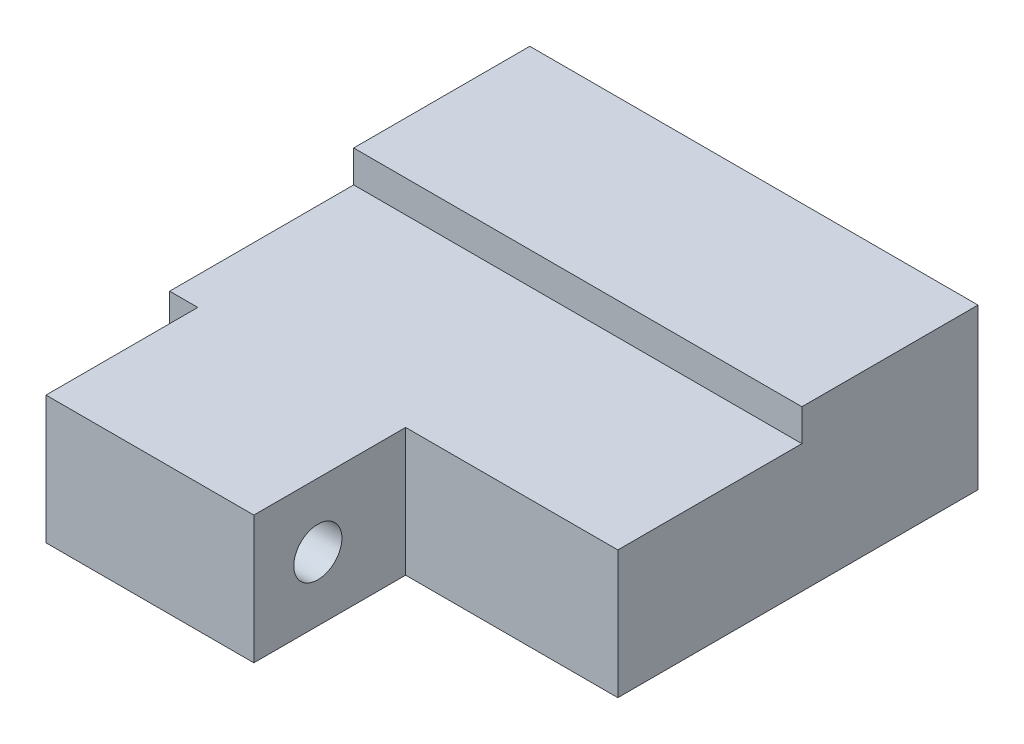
SolidWorks part; units mm, degrees
ref_plane "Front Plane" through (0, 0, 0) normal (0, 0, 1) x (1, 0, 0)
ref_plane "Top Plane" through (0, 0, 0) normal (0, 1, 0) x (1, 0, 0)
ref_plane "Right Plane" through (0, 0, 0) normal (1, 0, 0) x (0, 0, -1)
sketch "Sketch1" plane through (0, 0, 0) normal (0, 0, 1) x (1, 0, 0)
  line L0 (0, 0) -> (0, 28.9276) construction
  line L1 (-22.2377, -11.0998) -> (22.2377, -11.0998)
  line L2 (22.2377, -11.0998) -> (22.2377, 4.7752)
  line L3 (22.2377, 4.7752) -> (-22.2377, 4.7752)
  line L4 (-22.2377, 4.7752) -> (-22.2377, -11.0998)
  circle A0 centre (17.4625, 0) radius 2.3876
  circle A1 centre (-17.4625, 0) radius 2.3876
  dimension "D2" = 4.7752
  dimension "D1" = 34.925
  dimension "D3" = 4.7752
  dimension "D4" = 4.7752
  dimension "D5" = 4.7752
  dimension "D6" = 15.875
sketch "Sketch2" plane through (0, 0, 0) normal (0, 0, 1) x (1, 0, 0)
  line L0 (-22.2377, -11.0998) -> (22.2377, -11.0998) construction
  line L1 (22.2377, -11.0998) -> (22.2377, 4.7752) construction
  line L2 (22.2377, 4.7752) -> (-22.2377, 4.7752) construction
  line L3 (-22.2377, 4.7752) -> (-22.2377, -11.0998) construction
  line L4 (-22.2377, -11.0998) -> (22.2377, -11.0998)
  line L5 (22.2377, -11.0998) -> (22.2377, 4.7752)
  line L6 (22.2377, 4.7752) -> (-22.2377, 4.7752)
  line L7 (-22.2377, 4.7752) -> (-22.2377, -11.0998)
extrude "Boss-Extrude1" add sketch "Sketch2" along normal blind 50.8
sketch "Sketch3" plane through (0, 0, 0) normal (0, 1, 0) x (1, 0, 0)
  line L0 (22.2377, -35.7378) -> (1.1811, -35.7378)
  line L1 (22.2377, -50.8) -> (22.2377, 0) construction
  line L2 (1.1811, -35.7378) -> (1.1811, -50.8)
  line L3 (22.2377, -50.8) -> (-22.2377, -50.8) construction
  line L4 (1.1811, -50.8) -> (22.2377, -50.8)
  line L5 (22.2377, -50.8) -> (22.2377, -35.7378)
  line L6 (-19.4437, -50.8) -> (-19.4437, -35.7378)
  line L7 (-19.4437, -35.7378) -> (-22.2377, -35.7378)
  line L8 (-22.2377, -50.8) -> (-22.2377, 0) construction
  line L9 (-22.2377, -35.7378) -> (-22.2377, -50.8)
  line L10 (-22.2377, -50.8) -> (-19.4437, -50.8)
  line L11 (1.1811, -35.7378) -> (-19.4437, -35.7378) construction
  line L12 (-9.1313, -35.7378) -> (-9.1313, -28.6485) construction
  dimension "D1" = 20.6248
  dimension "D2" = 15.0622
  dimension "D3" = 1.1811
  dimension "D4" = 19.4437
  dimension "D5" = 1.1811
  dimension "D6" = 9.1313
extrude "Cut-Extrude1" cut sketch "Sketch3" against normal mid plane 25.4
sketch "Sketch4" plane through (0, 0, 0) normal (1, 0, 0) x (0, 0, -1)
  line L1 (-50.8, -11.0998) -> (-50.8, 4.7752) construction
  line L2 (-35.7378, -11.0998) -> (-50.8, -11.0998) construction
  circle A0 centre (-44.45, -4.7498) radius 2.3876
  dimension "D3" = 4.7752
  dimension "D1" = 6.35
  dimension "D2" = 6.35
extrude "Cut-Extrude2" cut sketch "Sketch4" against normal mid plane 50.8
sketch "Sketch5" plane through (0, 0, 0) normal (0, 0, -1) x (-1, 0, 0)
  circle A0 centre (-17.4625, 0) radius 2.3876 construction
  circle A1 centre (17.4625, 0) radius 2.3876 construction
  circle A2 centre (-17.4625, 0) radius 2.3876
  circle A3 centre (17.4625, 0) radius 2.3876
extrude "Cut-Extrude3" cut sketch "Sketch5" against normal blind 15.875
sketch "Sketch6" plane through (0, 0, 0) normal (1, 0, 0) x (0, 0, -1)
  line L0 (-17.4752, 4.7752) -> (-17.4752, 1.6002)
  line L1 (-35.7378, 4.7752) -> (0, 4.7752) construction
  line L2 (-17.4752, 1.6002) -> (-50.8, 1.6002)
  line L3 (-50.8, 4.7752) -> (-50.8, -11.0998) construction
  line L4 (-50.8, 1.6002) -> (-50.8, 4.7752)
  line L5 (-50.8, 4.7752) -> (-17.4752, 4.7752)
  dimension "D1" = 3.175
  dimension "D2" = 17.4752
extrude "Cut-Extrude5" cut sketch "Sketch6" along normal mid plane 76.2
